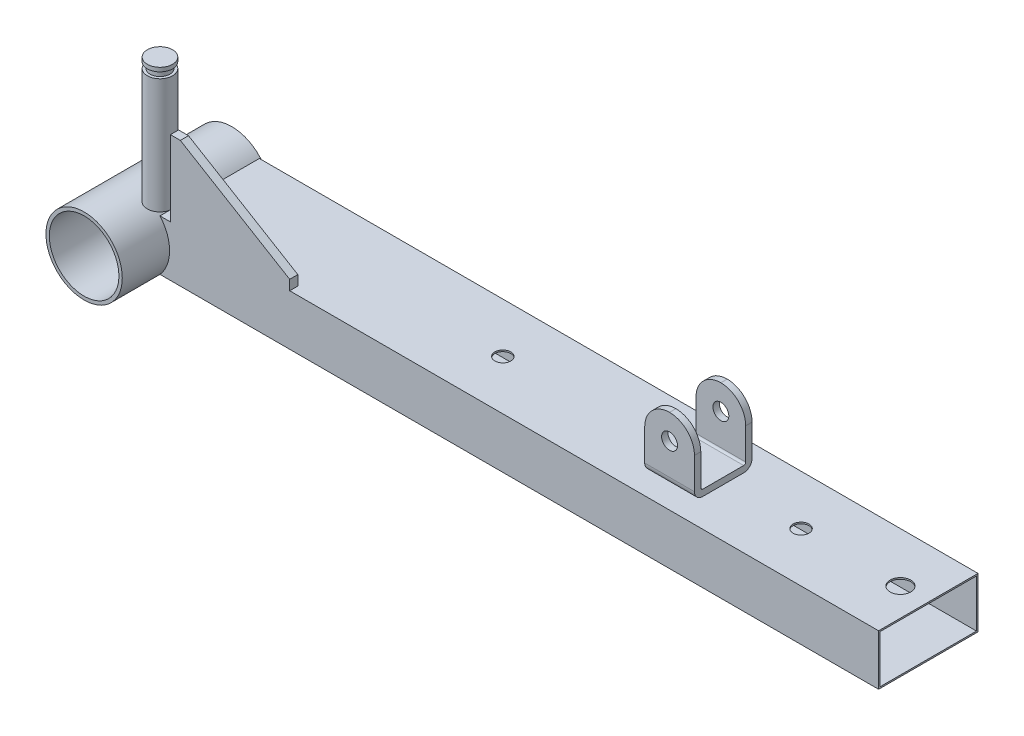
SolidWorks part; units mm, degrees
ref_plane "Plan1" through (0, 0, 0) normal (0, 0, 1) x (1, 0, 0)
ref_plane "Plan2" through (0, 0, 0) normal (0, 1, 0) x (1, 0, 0)
ref_plane "Plan3" through (0, 0, 0) normal (1, 0, 0) x (0, 0, -1)
sketch "Esquisse1" plane through (0, 0, 0) normal (0, 0, 1) x (1, 0, 0)
  circle A0 centre (0, 0) radius 19.2
  circle A1 centre (0, 0) radius 17.5
  dimension "D1" = 38.4
  dimension "D2" = 35
extrude "Base-Extrusion" add sketch "Esquisse1" along normal blind 74.3
ref_plane "Plan4" through (375.8, 0, 0) normal (1, 0, 0) x (0, 0, -1)
sketch "Esquisse2" plane through (375.8, 0, 0) normal (1, 0, 0) x (0, 0, -1)
  line L0 (0, -19.2) -> (0, 19.2) construction
  line L1 (-0.5, 12.75) -> (-50.5, 12.75)
  line L2 (-0.5, 12.75) -> (-0.5, -12.75)
  line L3 (-0.5, -12.75) -> (-50.5, -12.75)
  line L4 (-50.5, 12.75) -> (-50.5, -12.75)
  line L5 (-1.25, 12) -> (-49.75, 12)
  line L6 (-49.75, 12) -> (-49.75, -12)
  line L7 (-1.25, -12) -> (-49.75, -12)
  line L8 (-1.25, 12) -> (-1.25, -12)
  dimension "D1" = 50
  dimension "D2" = 25.5
  dimension "D3" = 0.5
  dimension "D4" = 12.75
  dimension "D5" = 0.75
extrude "Boss.-Extru.1" add sketch "Esquisse2" against normal up to next
ref_plane "Plan5" through (273.1, 0, 0) normal (1, 0, 0) x (0, 0, -1)
sketch "Esquisse9" plane through (273.1, 0, 0) normal (1, 0, 0) x (0, 0, -1)
  line L0 (-36.2345, 12.75) -> (-15.6345, 12.75)
  line L1 (-11.4345, 16.95) -> (-11.4345, 45.25)
  line L2 (-40.4345, 16.95) -> (-40.4345, 45.25)
  line L3 (-37.2345, 16.95) -> (-37.2345, 45.25)
  line L4 (-36.2345, 15.95) -> (-15.6345, 15.95)
  line L5 (-14.6345, 16.95) -> (-14.6345, 45.25)
  line L6 (-40.4345, 45.25) -> (-37.2345, 45.25)
  line L7 (-14.6345, 45.25) -> (-11.4345, 45.25)
  arc A0 (-37.2345, 16.95) -> (-36.2345, 15.95) centre (-36.2345, 16.95) ccw
  arc A1 (-15.6345, 15.95) -> (-14.6345, 16.95) centre (-15.6345, 16.95) ccw
  arc A2 (-36.2345, 12.75) -> (-40.4345, 16.95) centre (-36.2345, 16.95) cw
  arc A3 (-15.6345, 12.75) -> (-11.4345, 16.95) centre (-15.6345, 16.95) ccw
  point P15 (-40.4345, 12.75)
  point P18 (-11.4345, 12.75)
  dimension "D5" = 1
  dimension "D6" = 4.2
  dimension "D2" = 29
  dimension "D3" = 32.5
  dimension "D1" = 32.5
  dimension "D4" = 3.2
extrude "Boss.-Extru.7" add sketch "Esquisse9" against normal blind 25
fillet "Congé7" radius 12.5
other "Perçage1"
sketch "Esquisse10" plane through (0, 0, 40.4345) normal (0, 0, 1) x (1, 0, 0)
  circle A0 centre (260.6, 32.75) radius 4
  arc A1 (273.1, 32.75) -> (260.6, 45.25) centre (260.6, 32.75) ccw construction
  dimension "D1" = 8
ref_plane "Plan6" through (0, 17.75, 0) normal (0, 1, 0) x (-1, 0, 0)
sketch "Esquisse11" plane through (0, 17.75, 0) normal (0, 1, 0) x (-1, 0, 0)
  line L0 (19.2, 74.3) -> (-19.2, 74.3) construction
  line L1 (-375.8, 50.5) -> (-375.8, 0.5) construction
  circle A0 centre (-13.15, 49.3) radius 6.35
  dimension "D1" = 12.7
  dimension "D2" = 25
  dimension "D3" = 362.65
extrude "Boss.-Extru.11" add sketch "Esquisse11" along normal blind 58
sketch "Esquisse12" plane through (0, 75.75, 0) normal (0, 1, 0) x (-1, 0, 0)
  circle A0 centre (-13.15, 49.3) radius 5
  circle A1 centre (-13.15, 49.3) radius 6.35 construction
  dimension "D1" = 10
extrude "Boss.-Extru.12" add sketch "Esquisse12" along normal blind 3
sketch "Esquisse13" plane through (0, 78.75, 0) normal (0, 1, 0) x (-1, 0, 0)
  circle A0 centre (-13.15, 49.3) radius 6.35
  dimension "D1" = 12.7
extrude "Boss.-Extru.13" add sketch "Esquisse13" along normal blind 2
sketch "Esquisse14" plane through (0, 0, 50.5) normal (0, 0, 1) x (1, 0, 0)
  line L0 (19.6, 12.75) -> (79.6, 12.75)
  line L1 (14.3554, 12.75) -> (375.8, 12.75) construction
  line L2 (79.6, 12.75) -> (79.6, 17.75)
  line L3 (19.6, 12.75) -> (19.6, 50.75)
  line L4 (19.6, 50.75) -> (24.6, 50.75)
  line L5 (24.6, 50.75) -> (79.6, 17.75)
  circle A0 centre (0, 0) radius 17.5 construction
  dimension "D1" = 60
  dimension "D2" = 5
  dimension "D3" = 5
  dimension "D4" = 38
  dimension "D5" = 19.6
extrude "Boss.-Extru.14" add sketch "Esquisse14" against normal blind 4.1
other "Perçage2"
sketch "Esquisse16" plane through (0, 12.75, 0) normal (0, 1, 0) x (-1, 0, 0)
  line L0 (-375.8, 0.5) -> (-375.8, 50.5) construction
  line L1 (-79.6, 50.5) -> (-375.8, 50.5) construction
  line L2 (-372.9901, 25.5) -> (-62.9512, 25.5) construction
  line L3 (-14.3554, 0.5) -> (-375.8, 0.5) construction
  circle A0 centre (-311.8, 25.5) radius 4
  dimension "D1" = 8
  dimension "D2" = 64
other "Perçage3"
sketch "Esquisse17" plane through (0, -12.75, 0) normal (0, -1, 0) x (1, 0, 0)
  circle A0 centre (311.8, 25.5) radius 5.75
  circle A2 centre (311.8, 25.5) radius 4 construction
  dimension "D1" = 11.5
other "Perçage4"
sketch "Esquisse18" plane through (0, 12.75, 0) normal (0, 1, 0) x (-1, 0, 0)
  line L0 (-375.8, 0.5) -> (-375.8, 50.5) construction
  line L1 (-79.6, 50.5) -> (-375.8, 50.5) construction
  circle A0 centre (-361.8, 25.5) radius 5.2
  dimension "D1" = 10.4
  dimension "D2" = 14
  dimension "D3" = 25
pattern_linear "Répétition linéaire1" count 2 spacing 150
